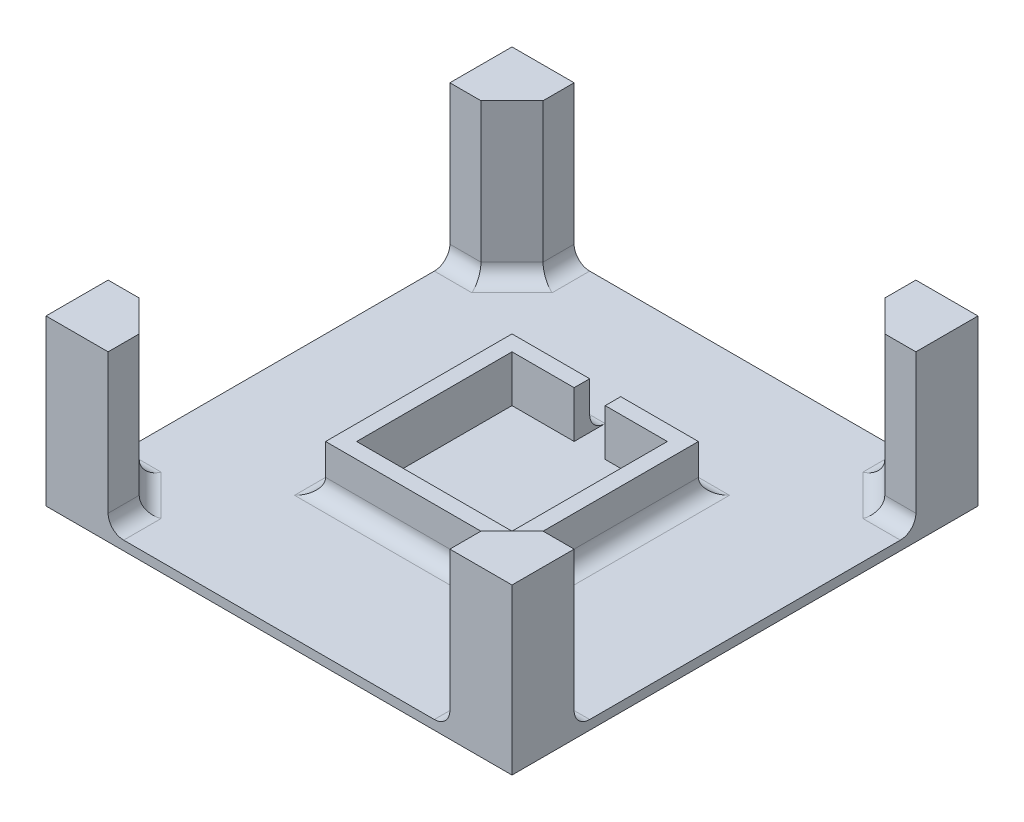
SolidWorks part; units mm, degrees
ref_plane "Alzado" through (0, 0, 0) normal (0, 0, 1) x (1, 0, 0)
ref_plane "Planta" through (0, 0, 0) normal (0, 1, 0) x (1, 0, 0)
ref_plane "Vista lateral" through (0, 0, 0) normal (1, 0, 0) x (0, 0, -1)
sketch "Croquis1" plane through (0, 0, 0) normal (0, 1, 0) x (1, 0, 0)
  line L1 (-75, 75) -> (75, 75)
  line L2 (-75, 75) -> (-75, -75)
  line L3 (-75, -75) -> (75, -75)
  line L4 (75, 75) -> (75, -75)
  line L5 (-75, 75) -> (75, -75) construction
  line L6 (-75, -75) -> (75, 75) construction
  point P0 (0, 0)
  dimension "D1" = 150
extrude "Saliente-Extruir1" add sketch "Croquis1" along normal mid plane 3
sketch "Croquis2" plane through (0, 1.5, 0) normal (0, 1, 0) x (1, 0, 0)
  line L0 (-75, -75) -> (-75, -55)
  line L1 (-75, 75) -> (-75, -75) construction
  line L2 (-75, -55) -> (-65, -55)
  line L3 (-65, -55) -> (-55, -65)
  line L4 (-55, -65) -> (-55, -75)
  line L5 (-75, -75) -> (75, -75) construction
  line L6 (-55, -75) -> (-75, -75)
  line L7 (0, 0) -> (0, 50000) construction
  line L8 (0, 0) -> (50000, 0) construction
  line L9 (55, -75) -> (75, -75)
  line L10 (55, -65) -> (55, -75)
  line L11 (65, -55) -> (55, -65)
  line L12 (75, -55) -> (65, -55)
  line L13 (75, -75) -> (75, -55)
  line L14 (75, 75) -> (75, 55)
  line L15 (75, 55) -> (65, 55)
  line L16 (65, 55) -> (55, 65)
  line L17 (55, 65) -> (55, 75)
  line L18 (55, 75) -> (75, 75)
  line L19 (-55, 75) -> (-75, 75)
  line L20 (-55, 65) -> (-55, 75)
  line L21 (-65, 55) -> (-55, 65)
  line L22 (-75, 55) -> (-65, 55)
  line L23 (-75, 75) -> (-75, 55)
  point P30 (0, 0)
  point P31 (0, 0)
  dimension "D1" = 20
  dimension "D2" = 10
  dimension "D3" = 135
extrude "Saliente-Extruir2" add sketch "Croquis2" along normal blind 50 contours L22 L21 L20 M10 M9 | L17 L16 L15 M8 M9 | L12 L11 L10 M8 M11 | L3 L4 L6 L0 L2
sketch "Croquis4" plane through (0, 1.5, 0) normal (0, 1, 0) x (1, 0, 0)
  line L0 (-30, 30) -> (30, 30)
  line L1 (-25, 25) -> (25, 25)
  line L2 (-25, 25) -> (-25, -25)
  line L3 (-25, -25) -> (25, -25)
  line L4 (25, 25) -> (25, -25)
  line L5 (-25, 25) -> (25, -25) construction
  line L6 (-25, -25) -> (25, 25) construction
  line L7 (30, 30) -> (30, -30)
  line L8 (-30, -30) -> (30, -30)
  line L9 (-30, 30) -> (-30, -30)
  point P0 (0, 0)
  point P10 (25, 25)
  dimension "D1" = 50
  dimension "D2" = 5
extrude "Saliente-Extruir3" add sketch "Croquis4" along normal blind 15
sketch "Croquis5" plane through (0, 0, -30) normal (0, 0, -1) x (-1, 0, 0)
  line L0 (-30, 16.5) -> (30, 16.5) construction
  line L1 (-5, 16.5) -> (5, 16.5)
  line L2 (-5, 16.5) -> (-5, 1.5)
  line L3 (-5, 1.5) -> (5, 1.5)
  line L4 (5, 16.5) -> (5, 1.5)
  line L5 (-55, 1.5) -> (55, 1.5) construction
  line L6 (0, 1.5) -> (0, 0) construction
  dimension "D1" = 10
extrude "Cortar-Extruir1" cut sketch "Croquis5" against normal up to next contours L4 L3 L2 L1
fillet "Redondeo2" radius 5 3 edges at (-70, 1.5, -55) (-60, 1.5, -60) (-55, 1.5, -70)
fillet "Redondeo3" radius 5 3 edges at (55, 1.5, -70) (70, 1.5, -55) (60, 1.5, -60)
fillet "Redondeo4" radius 5 3 edges at (-70, 1.5, 55) (-60, 1.5, 60) (-55, 1.5, 70)
fillet "Redondeo5" radius 5 3 edges at (70, 1.5, 55) (60, 1.5, 60) (55, 1.5, 70)
fillet "Redondeo6" radius 5 5 edges at (-17.5, 1.5, -30) (-30, 1.5, 0) (0, 1.5, 30) (30, 1.5, 0) (17.5, 1.5, -30)
